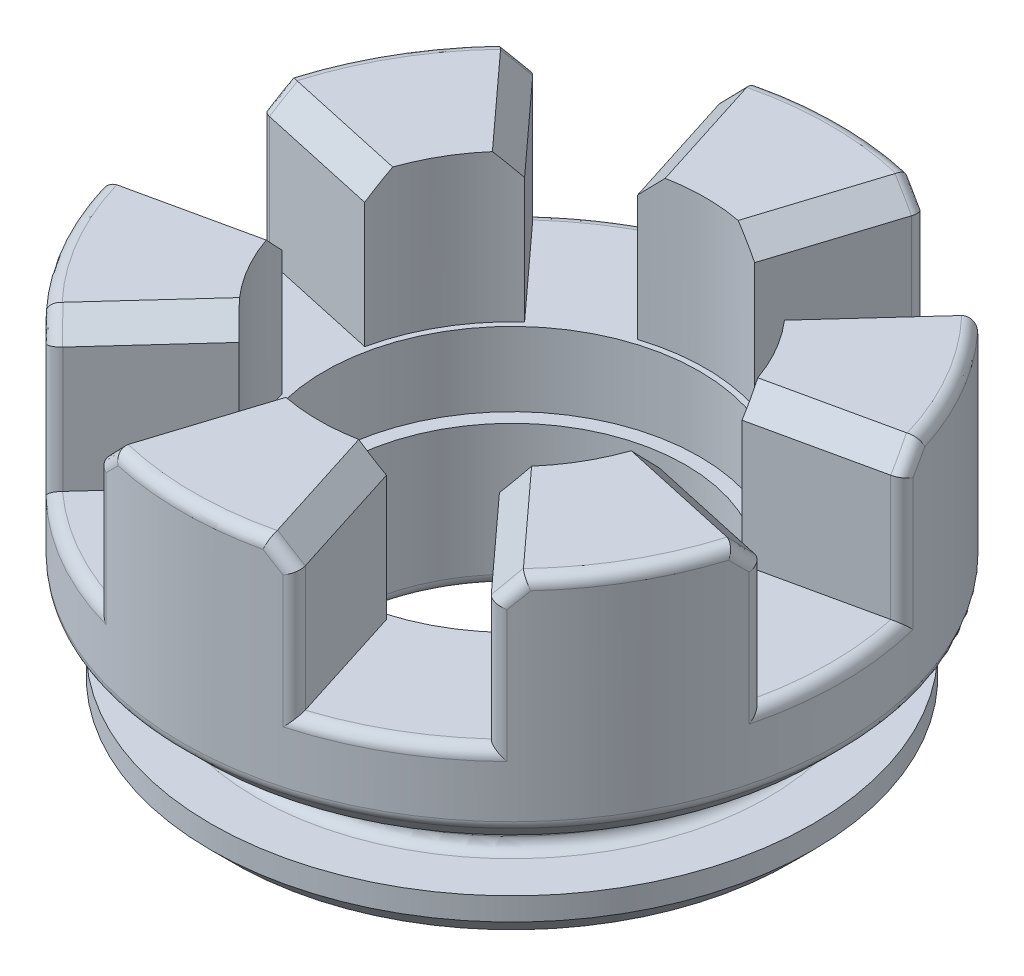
SolidWorks part; units mm, degrees
ref_plane "Front Plane" through (0, 0, 0) normal (0, 0, 1) x (1, 0, 0)
ref_plane "Top Plane" through (0, 0, 0) normal (0, 1, 0) x (1, 0, 0)
ref_plane "Right Plane" through (0, 0, 0) normal (1, 0, 0) x (0, 0, -1)
sketch "Sketch1" plane through (0, 0, 0) normal (0, 0, 1) x (1, 0, 0)
  line L0 (-16.5, 0) -> (-29, 0)
  line L1 (-29, 0) -> (-29, -8)
  line L2 (-29, -8) -> (-21.5, -8)
  line L3 (-21.5, -8) -> (-21.5, -13)
  line L4 (-21.5, -13) -> (-26.5, -13)
  line L5 (-26.5, -13) -> (-26.5, -17)
  line L6 (-26.5, -17) -> (-20.25, -17)
  line L7 (-20.25, -17) -> (-20.25, -19)
  line L8 (-20.25, -19) -> (-15.25, -19)
  line L9 (-15.25, -19) -> (-15.25, -6.5)
  line L10 (-15.25, -6.5) -> (-16.5, -6.5)
  line L11 (-16.5, -6.5) -> (-16.5, 0)
  line L12 (0, 0) -> (0, -16.1758) construction
  dimension "D1" = 16.5
  dimension "D2" = 15.25
  dimension "D3" = 5
  dimension "D4" = 6.25
  dimension "D5" = 2
  dimension "D6" = 4
  dimension "D7" = 5
  dimension "D8" = 8
  dimension "D9" = 6.5
  dimension "D10" = 12.5
  dimension "D11" = 7.5
revolve "Revolve1" add sketch "Sketch1" angle 360 about L12
sketch "Sketch2" plane through (0, 0, 0) normal (0, 1, 0) x (1, 0, 0)
  line L0 (0, 0) -> (-9.9424, 31.2666) construction
  line L1 (0, 0) -> (9.9424, 31.2666) construction
  line L2 (9.9424, 31.2666) -> (0, 31.2666) construction
  line L3 (0, 31.2666) -> (0, 0) construction
  line L4 (-8.788, 27.6364) -> (-5.1516, 16.2006)
  line L5 (5.1516, 16.2006) -> (8.788, 27.6364)
  circle A0 centre (0, 0) radius 17 construction
  arc A1 (-5.1516, 16.2006) -> (5.1516, 16.2006) centre (0, 0) cw
  arc A2 (-8.788, 27.6364) -> (8.788, 27.6364) centre (0, 0) cw
  circle A3 centre (0, 0) radius 29 construction
  dimension "D1" = 34
  dimension "D2" = 35.28
extrude "Boss-Extrude1" add sketch "Sketch2" along normal blind 13
chamfer "Chamfer1" distance 2 angle 45 2 edges at (-6.9698, 13, -21.9185) (6.9698, 13, -21.9185)
pattern_circular "CirPattern1" count 6 over 360 about axis through (0, 0, 0) along (0, 1, 0) of "Chamfer1", "Boss-Extrude1"
chamfer "Chamfer2" distance 2 angle 45 2 edges at (0, -17, 26.5) (0, -8, 29)
fillet "Fillet1" radius 1 42 edges at (0, -19, 15.25) (0, -19, 20.25) (0, -17, 20.25) (25.1147, 13, -14.5) (19.5398, 5.5, -21.4289) (28.3278, 5.5, -6.2075) (28.0968, 12.0006, -7.1813) (20.2675, 12.0006, -20.7419) (0, -13, 21.5) (25.1147, 13, 14.5) (0, -8, 21.5) (28.3278, 5.5, 6.2075) (19.5398, 5.5, 21.4289) (20.2675, 12.0006, 20.7419) (28.0968, 12.0006, 7.1813) (0, 13, 29) (8.788, 5.5, 27.6364) (-8.788, 5.5, 27.6364) (-7.8292, 12.0006, 27.9232) (7.8292, 12.0006, 27.9232) (-25.1147, 13, 14.5) (-19.5398, 5.5, 21.4289) (-28.3278, 5.5, 6.2075) (-28.0968, 12.0006, 7.1813) (-20.2675, 12.0006, 20.7419) (-25.1147, 13, -14.5) (-28.3278, 5.5, -6.2075) (-19.5398, 5.5, -21.4289) (-20.2675, 12.0006, -20.7419) (-28.0968, 12.0006, -7.1813) (0, -6, -29) (-14.5, 0, -25.1147) (0, 13, -29) (-8.788, 5.5, -27.6364) (8.788, 5.5, -27.6364) (7.8292, 12.0006, -27.9232) (-7.8292, 12.0006, -27.9232) (-29, 0, 0) (-14.5, 0, 25.1147) (14.5, 0, 25.1147) (29, 0, 0) (14.5, 0, -25.1147)
